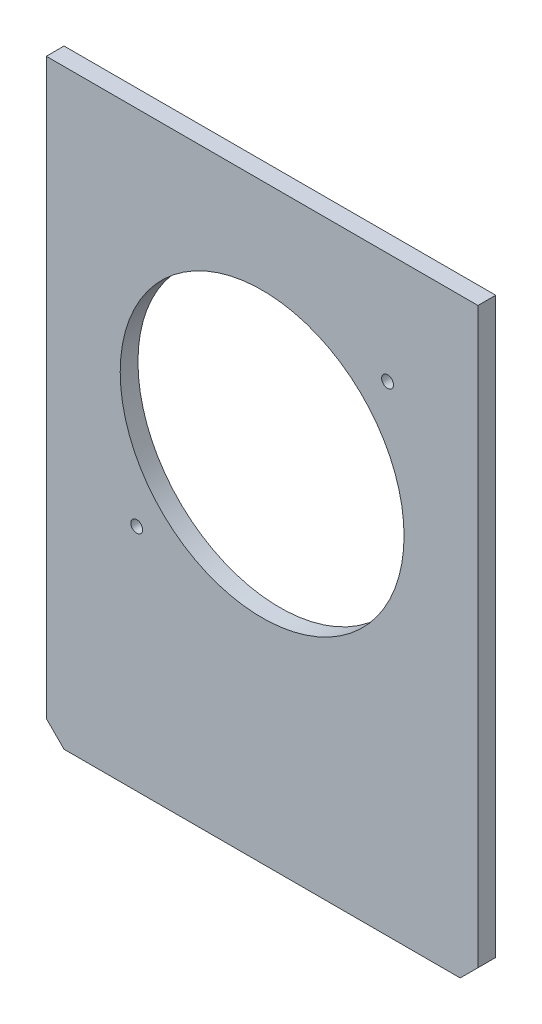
SolidWorks part; units mm, degrees
ref_plane "Face" through (0, 0, 0) normal (0, 0, 1) x (1, 0, 0)
ref_plane "Dessus" through (0, 0, 0) normal (0, 1, 0) x (1, 0, 0)
ref_plane "Droite" through (0, 0, 0) normal (1, 0, 0) x (0, 0, -1)
sketch "Esquisse1" plane through (0, 0, 0) normal (0, 0, 1) x (1, 0, 0)
  line L0 (19.4639, -10.3957) -> (40.6771, 10.8175) construction
  line L1 (-17.0361, 29.6043) -> (55.9639, 29.6043)
  line L2 (-17.0361, 29.6043) -> (-17.0361, -70.3957)
  line L3 (-17.0361, -70.3957) -> (55.9639, -70.3957)
  line L4 (55.9639, 29.6043) -> (55.9639, -70.3957)
  line L5 (19.4639, -10.3957) -> (-1.7493, -31.6089) construction
  line L6 (19.4639, 29.6043) -> (19.4639, -10.3957) construction
  circle A0 centre (19.4639, -10.3957) radius 24
  circle A1 centre (40.6771, 10.8175) radius 1
  circle A2 centre (-1.7493, -31.6089) radius 1
  dimension "D4" = 48
  dimension "D6" = 30
  dimension "D1" = 73
  dimension "D2" = 100
  dimension "D3" = 40
  dimension "D5" = 30
extrude "Extrusion1" add sketch "Esquisse1" along normal blind 3
chamfer "Chanfrein1" distance 3 angle 45 2 edges at (-17.0361, -70.3957, 1.5) (55.9639, -70.3957, 1.5)
